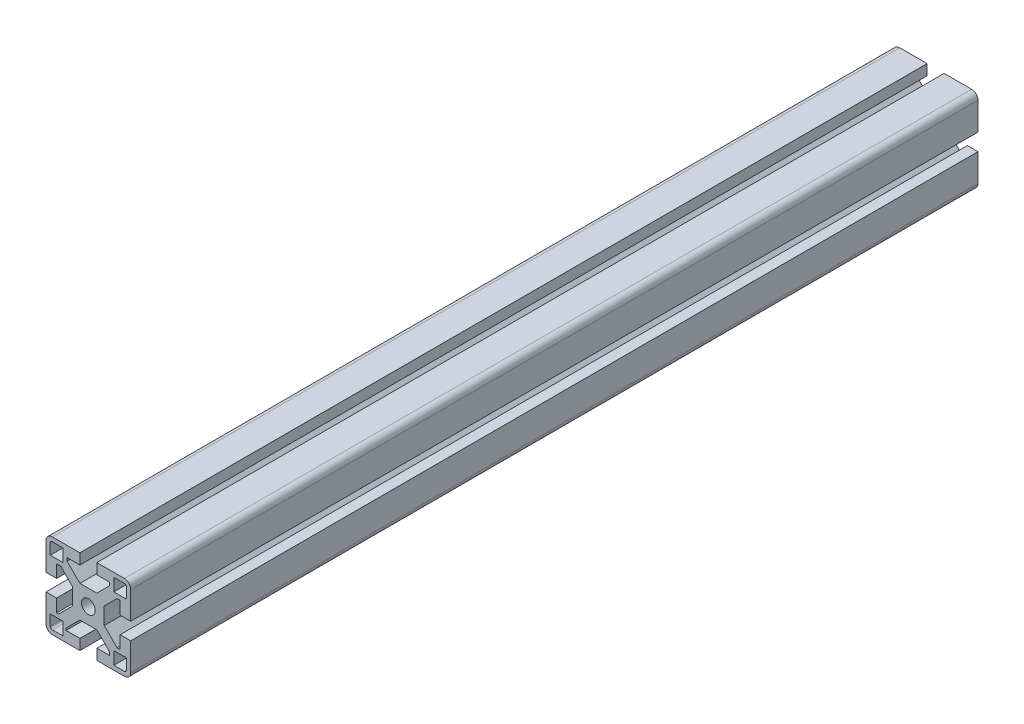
SolidWorks part; units mm, degrees
ref_plane "Alzado" through (0, 0, 0) normal (0, 0, 1) x (1, 0, 0)
ref_plane "Planta" through (0, 0, 0) normal (0, 1, 0) x (1, 0, 0)
ref_plane "Vista lateral" through (0, 0, 0) normal (1, 0, 0) x (0, 0, -1)
sketch "Croquis1" plane through (0, 0, 0) normal (0, 0, 1) x (1, 0, 0)
  line L0 (-18, 12) -> (-12, 12)
  line L1 (-12, 12) -> (-12, 18)
  line L2 (-17, 18) -> (-12, 18)
  line L3 (-18, 12) -> (-18, 17)
  line L4 (12, 12) -> (18, 12)
  line L5 (12, 12) -> (12, 18)
  line L6 (12, 18) -> (17, 18)
  line L7 (18, 12) -> (18, 17)
  line L8 (-17, -18) -> (-12, -18)
  line L9 (-12, -18) -> (-12, -12)
  line L10 (-18, -12) -> (-12, -12)
  line L11 (-18, -17) -> (-18, -12)
  line L12 (18, -12) -> (12, -12)
  line L13 (18, -17) -> (18, -12)
  line L14 (17, -18) -> (12, -18)
  line L15 (12, -18) -> (12, -12)
  line L16 (-4, 7.5) -> (4, 7.5)
  line L17 (-17, 20) -> (-4, 20)
  line L18 (-7.5, -3.55) -> (-7.5, 4.45)
  line L19 (-4, -7.5) -> (4, -7.5)
  line L20 (7.5, -4) -> (7.5, 4)
  line L21 (20, -4) -> (15, -4)
  line L22 (4, 20) -> (4, 15)
  line L24 (4, 20) -> (17, 20)
  line L25 (-17, -20) -> (-4, -20)
  line L26 (-4, -20) -> (-4, -15)
  line L27 (17, -20) -> (4, -20)
  line L28 (-15, -10.05) -> (-15, -4)
  line L29 (-20, 4) -> (-20, 17)
  line L30 (-20, -17) -> (-20, -4)
  line L31 (-20, -4) -> (-15, -4)
  line L32 (4, -20) -> (4, -15)
  line L33 (-4, 20) -> (-4, 15)
  line L34 (20, 4) -> (20, 17)
  line L35 (20, -17) -> (20, -4)
  line L36 (20, 4) -> (15, 4)
  line L37 (4, -15) -> (10.05, -15)
  line L38 (-10.5, -15) -> (-4, -15)
  line L39 (-10.5, -14) -> (-4, -7.5)
  line L40 (-10.5, -14) -> (-10.5, -15)
  line L41 (4, -7.5) -> (10.05, -13.55)
  line L42 (10.05, -15) -> (10.05, -13.55)
  line L43 (-7.5, -3.55) -> (-14, -10.05)
  line L44 (-15, -10.05) -> (-14, -10.05)
  line L45 (-20, 4) -> (-15, 4)
  line L46 (-15, 4) -> (-15, 10.05)
  line L47 (-7.5, 4.45) -> (-13.1, 10.05)
  line L48 (-15, 10.05) -> (-13.1, 10.05)
  line L49 (4, 15) -> (10.05, 15)
  line L50 (4, 7.5) -> (10.05, 13.55)
  line L51 (10.05, 13.55) -> (10.05, 15)
  line L52 (-10.0629, 15) -> (-4, 15)
  line L53 (-10.0629, 13.55) -> (-4, 7.5)
  line L54 (-10.0629, 13.55) -> (-10.0629, 15)
  line L55 (15, 4) -> (15, 10.05)
  line L56 (15, -10.05) -> (15, -4)
  line L57 (7.5, -4) -> (13.55, -10.05)
  line L58 (13.55, -10.05) -> (15, -10.05)
  line L59 (7.5, 4) -> (13.55, 10.05)
  line L60 (13.55, 10.05) -> (15, 10.05)
  arc A0 (-18, 17) -> (-17, 18) centre (-17, 17) cw
  arc A1 (18, 17) -> (17, 18) centre (17, 17) ccw
  arc A2 (-18, -17) -> (-17, -18) centre (-17, -17) ccw
  arc A3 (17, -18) -> (18, -17) centre (17, -17) ccw
  circle A4 centre (0, 0) radius 3.25
  arc A5 (17, 20) -> (20, 17) centre (17, 17) cw
  arc A6 (-20, 17) -> (-17, 20) centre (-17, 17) cw
  arc A7 (-17, -20) -> (-20, -17) centre (-17, -17) cw
  arc A8 (17, -20) -> (20, -17) centre (17, -17) ccw
extrude "Extruir5" add sketch "Croquis1" along normal blind 400
